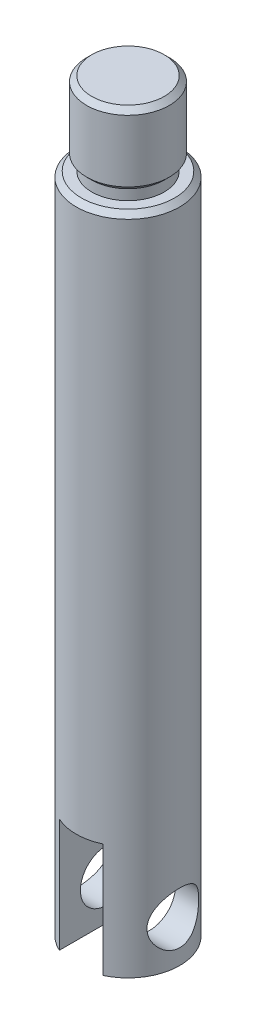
SolidWorks part; units mm, degrees
ref_plane "Front Plane" through (0, 0, 0) normal (0, 0, 1) x (1, 0, 0)
ref_plane "Top Plane" through (0, 0, 0) normal (0, 1, 0) x (1, 0, 0)
ref_plane "Right Plane" through (0, 0, 0) normal (1, 0, 0) x (0, 0, -1)
sketch "Sketch1" plane through (0, 0, 0) normal (0, 1, 0) x (1, 0, 0)
  circle A0 centre (0, 0) radius 2
  dimension "D1" = 4
extrude "Boss-Extrude1" add sketch "Sketch1" along normal blind 3.5
chamfer "Chamfer1" distance 0.25 angle 45 2 edges at (0, 0, 2) (0, 3.5, 2)
sketch "Sketch2" plane through (0, 0, 0) normal (0, -1, 0) x (1, 0, 0)
  circle A0 centre (0, 0) radius 1.75
  dimension "D1" = 3.5
extrude "Boss-Extrude2" add sketch "Sketch2" along normal blind 0.5
sketch "Sketch3" plane through (0, -0.5, 0) normal (0, -1, 0) x (1, 0, 0)
  circle A0 centre (0, 0) radius 2.5
  dimension "D1" = 5
extrude "Boss-Extrude3" add sketch "Sketch3" along normal blind 32 contours A0
chamfer "Chamfer2" distance 0.25 angle 45 1 edges at (0, -0.5, -2.5)
sketch "Sketch4" plane through (0, 0, 0) normal (1, 0, 0) x (0, 0, -1)
  line L0 (-2.5, -32.5) -> (2.5, -32.5) construction
  circle A0 centre (0, -30.5) radius 1.25
  dimension "D1" = 2.5
  dimension "D2" = 2
  dimension "D3" = 30.5
extrude "Cut-Extrude3" cut sketch "Sketch4" against normal mid plane 8.5
sketch "Sketch5" plane through (0, -32.5, 0) normal (0, -1, 0) x (1, 0, 0)
  line L1 (1.05, -2.598) -> (-1.05, -2.598)
  line L2 (1.05, -2.598) -> (1.05, 2.598)
  line L3 (1.05, 2.598) -> (-1.05, 2.598)
  line L4 (-1.05, -2.598) -> (-1.05, 2.598)
  line L5 (1.05, -2.598) -> (-1.05, 2.598) construction
  line L6 (1.05, 2.598) -> (-1.05, -2.598) construction
  point P0 (0, 0)
  dimension "D1" = 2.1
extrude "Cut-Extrude4" cut sketch "Sketch5" against normal blind 5.5
